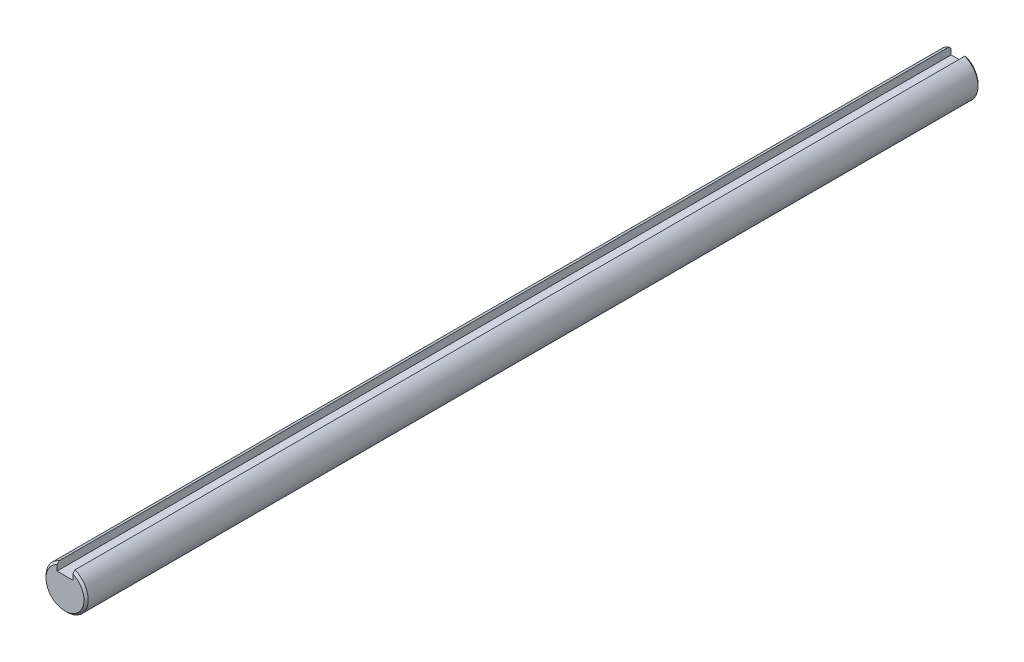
SolidWorks part; units mm, degrees
ref_plane "Front Plane" through (0, 0, 0) normal (0, 0, 1) x (1, 0, 0)
ref_plane "Top Plane" through (0, 0, 0) normal (0, 1, 0) x (1, 0, 0)
ref_plane "Right Plane" through (0, 0, 0) normal (1, 0, 0) x (0, 0, -1)
sketch "Sketch1" plane through (0, 0, 0) normal (0, 0, 1) x (1, 0, 0)
  line L0 (-2.2451, -2.2451) -> (-1.1225, -1.1225) construction
  line L1 (3.4925, 0) -> (-3.4925, 0) construction
  line L2 (0, 0) -> (0, 3.175) construction
  line L4 (-1.1906, 3.175) -> (1.1906, 3.175) construction
  line L5 (-1.1906, 3.175) -> (-1.1906, 1.7527) construction
  line L6 (-1.1906, 1.7527) -> (1.1906, 1.7527) construction
  line L7 (1.1906, 3.175) -> (1.1906, 1.7527) construction
  line L8 (-1.1906, 3.175) -> (1.1906, 1.7527) construction
  line L9 (-1.1906, 1.7527) -> (1.1906, 3.175) construction
  circle A0 centre (0, 0) radius 1.5875 construction
  circle A1 centre (0, 0) radius 3.175 construction
  point P6 (0, 2.4638)
  point P16 (-1.1906, 2.9433)
sketch "Sketch2" plane through (0, 0, 0) normal (1, 0, 0) x (0, 0, -1)
  line L0 (-67.31, -3.175) -> (67.31, -3.175) construction
  line L1 (0, 3.175) -> (0, -3.175) construction
  line L2 (0, 3.175) -> (0, -3.175) construction
  point P3 (54.61, -3.175)
  point P4 (-54.61, -3.175)
sketch "Sketch3" plane through (0, 0, 0) normal (0, 0, 1) x (1, 0, 0)
  circle A1 centre (0, 0) radius 3.175 construction
  circle A3 centre (0, 0) radius 3.175
extrude "Boss-Extrude2" add sketch "Sketch3" along normal up to vertex (67.31 mm away) and the other way up to vertex (67.31 mm away)
sketch "Sketch10" plane through (0, 0, 0) normal (0, 0, 1) x (1, 0, 0)
  line L1 (1.1906, 3.175) -> (1.1906, 1.7527) construction
  line L2 (-1.1906, 1.7527) -> (1.1906, 1.7527) construction
  line L3 (-1.1906, 3.175) -> (-1.1906, 1.7527) construction
  line L4 (-1.1906, 3.175) -> (1.1906, 3.175) construction
  line L5 (1.1906, 3.175) -> (1.1906, 1.7527)
  line L6 (-1.1906, 1.7527) -> (1.1906, 1.7527)
  line L7 (-1.1906, 3.175) -> (-1.1906, 1.7527)
  line L8 (-1.1906, 3.175) -> (1.1906, 3.175)
extrude "Cut-Extrude5" cut sketch "Sketch10" against normal through all both and the other way through all
chamfer "Chamfer1" distance 0.3175 angle 45 2 edges at (0, -3.175, 67.31) (0, -3.175, -67.31)
equation "\"D1@Chamfer1\"= \"Diameter@Sketch1\" / 20"
equation "\"D1@Sketch2\"=\"Diameter@Sketch1\"*2"
equation "\"D2@Sketch2\"=\"D1@Sketch2\""
